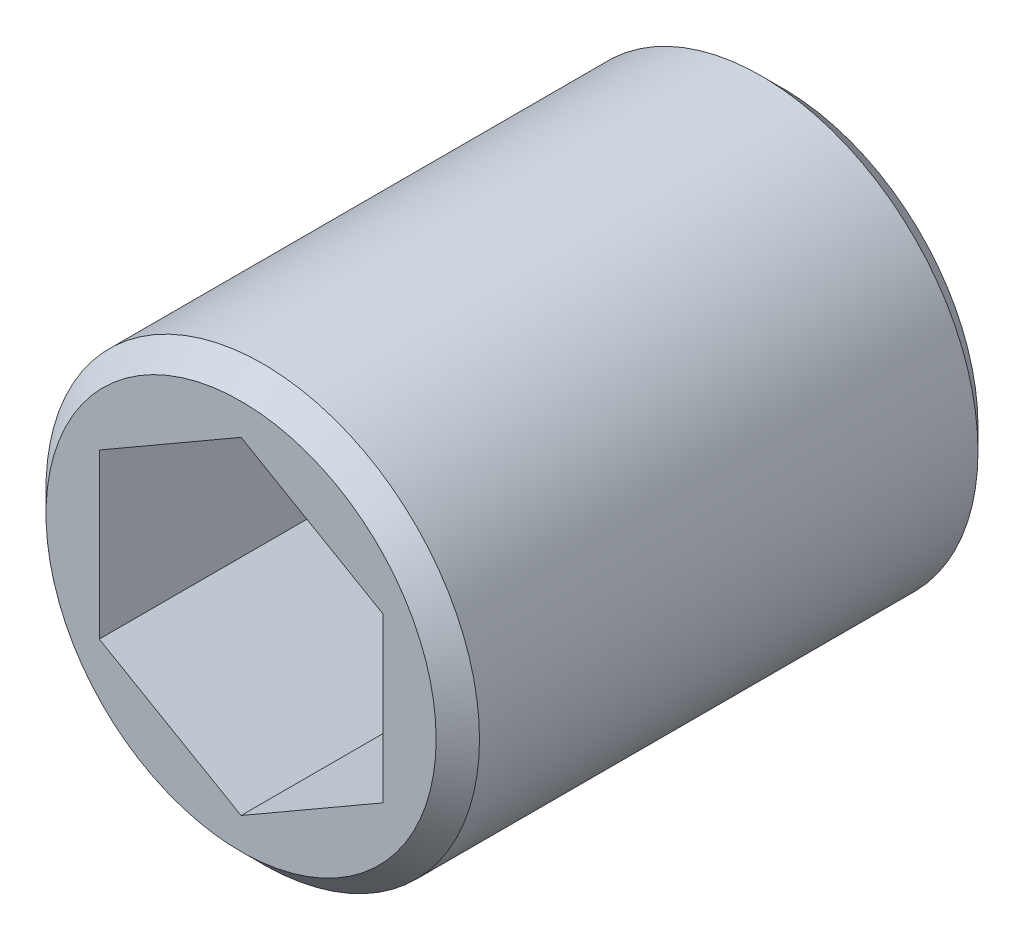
SolidWorks part; units mm, degrees
ref_plane "Front Plane" through (0, 0, 0) normal (0, 0, 1) x (1, 0, 0)
ref_plane "Top Plane" through (0, 0, 0) normal (0, 1, 0) x (1, 0, 0)
ref_plane "Right Plane" through (0, 0, 0) normal (1, 0, 0) x (0, 0, -1)
sketch "Sketch1" plane through (0, 0, 0) normal (0, 0, 1) x (1, 0, 0)
  circle A0 centre (0, 0) radius 1.27
  dimension "D1" = 2.54
extrude "Boss-Extrude1" add sketch "Sketch1" along normal blind 3.175
chamfer "Chamfer1" distance 0.127 angle 45 2 edges at (1.27, 0, 3.175) (1.27, 0, 0)
sketch "Sketch2" plane through (0, 0, 3.175) normal (0, 0, 1) x (1, 0, 0)
  line L1 (0, 0.9595) -> (-0.831, 0.4798)
  line L2 (-0.831, 0.4798) -> (-0.831, -0.4798)
  line L3 (-0.831, -0.4798) -> (0, -0.9595)
  line L4 (0, -0.9595) -> (0.831, -0.4798)
  line L5 (0.831, -0.4798) -> (0.831, 0.4798)
  line L6 (0.831, 0.4798) -> (0, 0.9595)
  circle A0 centre (0, 0) radius 0.831 construction
extrude "Cut-Extrude1" cut sketch "Sketch2" against normal blind 1.5875
